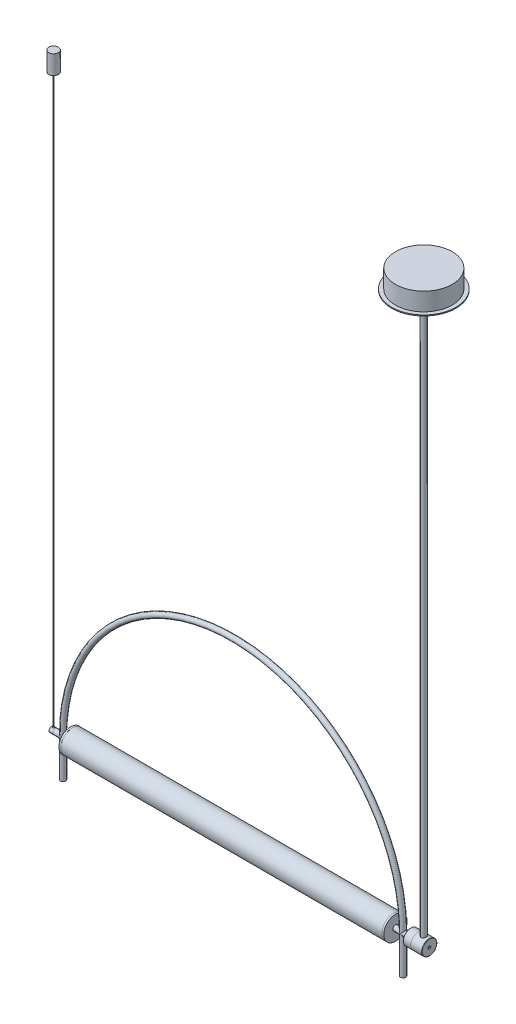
SolidWorks part; units mm, degrees
ref_plane "Alzado" through (0, 0, 0) normal (0, 0, 1) x (1, 0, 0)
ref_plane "Planta" through (0, 0, 0) normal (0, 1, 0) x (1, 0, 0)
ref_plane "Vista lateral" through (0, 0, 0) normal (1, 0, 0) x (0, 0, -1)
sketch "Croquis1" plane through (0, 0, 0) normal (0, 0, 1) x (1, 0, 0)
  line L0 (-450, 0) -> (-450, -100)
  line L1 (450, 0) -> (450, -100)
  arc A0 (450, 0) -> (-450, 0) centre (0, 0) ccw
  dimension "D1" = 900
  dimension "D2" = 100
  dimension "D3" = 100
sweep "Barrer1" add path "Croquis1" parameters "D3"=14
sketch "Croquis14" plane through (0, 0, 0) normal (0, 0, 1) x (1, 0, 0)
  line L0 (-450, 0) -> (-430, 0)
  line L1 (-450, 0) -> (-470, 0)
  circle A0 centre (0, 0) radius 450 construction
  dimension "D1" = 900
  dimension "D2" = 20
  dimension "D3" = 20
sweep "Barrer2" add path "Croquis14" parameters "D3"=14
mirror "Simetría1" about plane through (0, 0, 0) normal (1, 0, 0) of "Barrer2"
sketch "Croquis29" plane through (-430, 0, 0) normal (1, 0, 0) x (0, 0, -1)
  circle A0 centre (0, 0) radius 31
  dimension "D1" = 62
extrude "Saliente-Extruir1" add sketch "Croquis29" along normal blind 5 separate body
shell "Vaciado1" thickness 1
sketch "Croquis30" plane through (-429, 0, 0) normal (1, 0, 0) x (0, 0, -1)
  circle A0 centre (0, 0) radius 30.8885
  circle A1 centre (0, 0) radius 28.8885
  dimension "D1" = 2
mirror "Simetría4" about plane through (0, 0, 0) normal (1, 0, 0)
extrude "Saliente-Extruir2" add sketch "Croquis30" along normal up to next separate body
sketch "Croquis31" plane through (0, 0, 0) normal (0, 0, 1) x (1, 0, 0)
  line L0 (518, 0) -> (578, 0) construction
  line L1 (578, 0) -> (518, 0)
  line L3 (470, -7) -> (470, 7) construction
  arc A1 (518, 0) -> (578, 0) centre (548, 0) ccw
  dimension "D1" = 60
  dimension "D2" = 48
sketch "Croquis32" plane through (470, 0, 0) normal (1, 0, 0) x (0, 0, -1)
  circle A0 centre (0, 0) radius 20
  dimension "D1" = 40
extrude "Saliente-Extruir3" add sketch "Croquis32" along normal blind 20 separate body
sketch "Croquis33" plane through (490, 0, 0) normal (1, 0, 0) x (0, 0, -1)
  circle A1 centre (0, 0) radius 20
  circle A3 centre (0, 0) radius 20
  dimension "D1" = 0
extrude "Saliente-Extruir4" add sketch "Croquis33" along normal blind 30 separate body
sketch "Croquis34" plane through (0, 0, 0) normal (0, 1, 0) x (1, 0, 0)
  line L1 (520, -20) -> (520, 20) construction
  circle A0 centre (505, 0) radius 7
  dimension "D1" = 14
  dimension "D2" = 15
extrude "Saliente-Extruir5" add sketch "Croquis34" along normal blind 1500
fillet "Redondeo1" radius 1 1 edges at (520, 20, 0)
fillet "Redondeo2" radius 1 1 edges at (470, 20, 0)
hole_wizard "Avellanado para tornillo con cabeza ovalada de #61" positions "Croquis63" profile "Croquis62" countersink size "#6" standard "Ansi Inch"
sketch "Croquis63" plane through (520, 0, 0) normal (1, 0, 0) x (0, 0, -1)
  point P0 (0, 0)
sketch "Croquis62" plane through (520, 0, 0) normal (0, 1, 0) x (0, 0, -1)
  line L0 (0, 0) -> (0, 51.1408)
  line L1 (0, 51.1408) -> (1.8986, 50)
  line L2 (1.8986, 50) -> (1.8986, 1.892)
  line L3 (1.8986, 1.892) -> (3.5433, 0)
  line L5 (3.5433, 0) -> (0, 0)
  line L6 (-1.8986, 1.892) -> (-3.5433, 0) construction
  line L10 (0, 51.1408) -> (-1.8987, 50) construction
  line L11 (0, -6.35) -> (0, 107.95) construction
  dimension "Diámetro de taladro" = 3.7973
  dimension "Profundidad de taladro" = 50
  dimension "Ángulo de avellanado cercano" = 7.0866
  dimension "Ángulo de avellanado lejano" = 82
  dimension "Ángulo de perforador" = 118
sketch "Croquis64" plane through (-470, 0, 0) normal (-1, 0, 0) x (0, 0, 1)
  circle A0 centre (0, 0) radius 7
extrude "Saliente-Extruir6" add sketch "Croquis64" along normal blind 10 separate body
sketch "Croquis65" plane through (0, 0, 0) normal (0, 1, 0) x (1, 0, 0)
  circle A0 centre (-475, 0) radius 2
extrude "Saliente-Extruir7" add sketch "Croquis65" along normal blind 10
sketch "Croquis66" plane through (0, 10, 0) normal (0, 1, 0) x (1, 0, 0)
  circle A0 centre (-475, 0) radius 1
extrude "Saliente-Extruir8" add sketch "Croquis66" along normal blind 1500 separate body
sketch "Croquis67" plane through (0, 1500, 0) normal (0, 1, 0) x (1, 0, 0)
  circle A0 centre (505, 0) radius 84.963
  dimension "D1" = 169.926
extrude "Saliente-Extruir9" add sketch "Croquis67" along normal blind 2.54
sketch "Croquis68" plane through (0, 1502.54, 0) normal (0, 1, 0) x (1, 0, 0)
  circle A0 centre (505, 0) radius 75.057
  dimension "D1" = 150.114
extrude "Saliente-Extruir10" add sketch "Croquis68" along normal blind 47.498
sketch "Croquis69" plane through (0, 1510, 0) normal (0, 1, 0) x (1, 0, 0)
  circle A0 centre (-475, 0) radius 12.7
  dimension "D1" = 25.4
extrude "Saliente-Extruir11" add sketch "Croquis69" along normal blind 50.038
